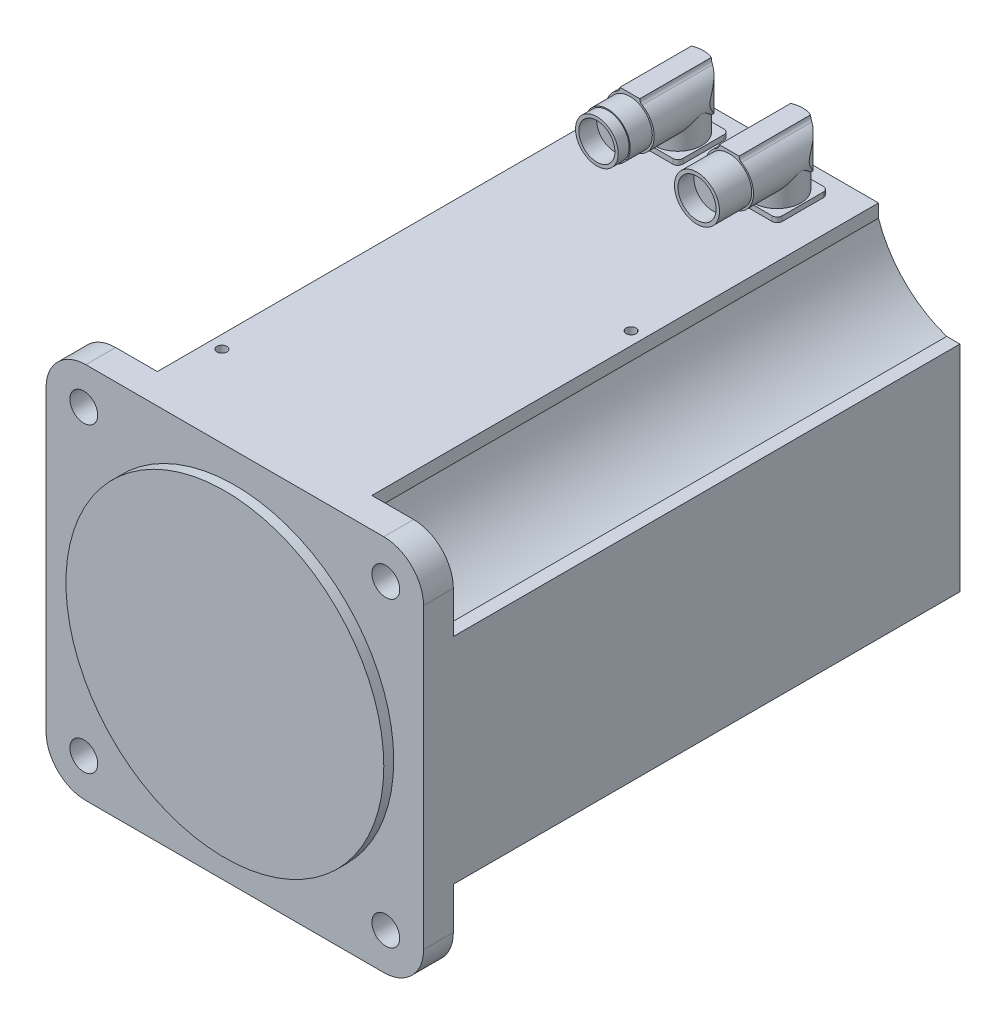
SolidWorks part; units mm, degrees
ref_plane "Piano1 (Front/Back)" through (0, 0, 0) normal (0, 0, 1) x (1, 0, 0)
ref_plane "Piano2 (Top/Bottom)" through (0, 0, 0) normal (0, 1, 0) x (1, 0, 0)
ref_plane "Piano3 (Left/Right)" through (0, 0, 0) normal (1, 0, 0) x (0, 0, -1)
imported_body "Importato1"
hole_wizard "M6 Foro filettato profondo1" positions "Schizzo2" profile "Schizzo1" tap size "M6" standard "ISO"
sketch "Schizzo2" plane through (0, 95, 0) normal (0, 1, 0) x (-1, 0, 0)
  line L0 (75, 15.75) -> (-75, 15.75) construction
  point P0 (47.5, -25.25)
  point P1 (-47.5, -136.25)
  dimension "D1" = 41
  dimension "D2" = 152
  dimension "D3" = 47.5
  dimension "D4" = 47.5
sketch "Schizzo1" plane through (-47.5, 95, -25.25) normal (1, 0, 0) x (0, 0, 1)
  line L0 (0, 0) -> (0, 18.5022)
  line L1 (0, 18.5022) -> (2.5, 17)
  line L2 (2.5, 17) -> (2.5, 0)
  line L5 (2.5, 0) -> (0, 0)
  line L10 (0, 18.5022) -> (-2.5, 17) construction
  line L11 (0, -6.35) -> (0, 107.95) construction
  dimension "Tap Drill Dia." = 5
  dimension "Tap Drill Depth" = 17
  dimension "Drill Angle" = 118
